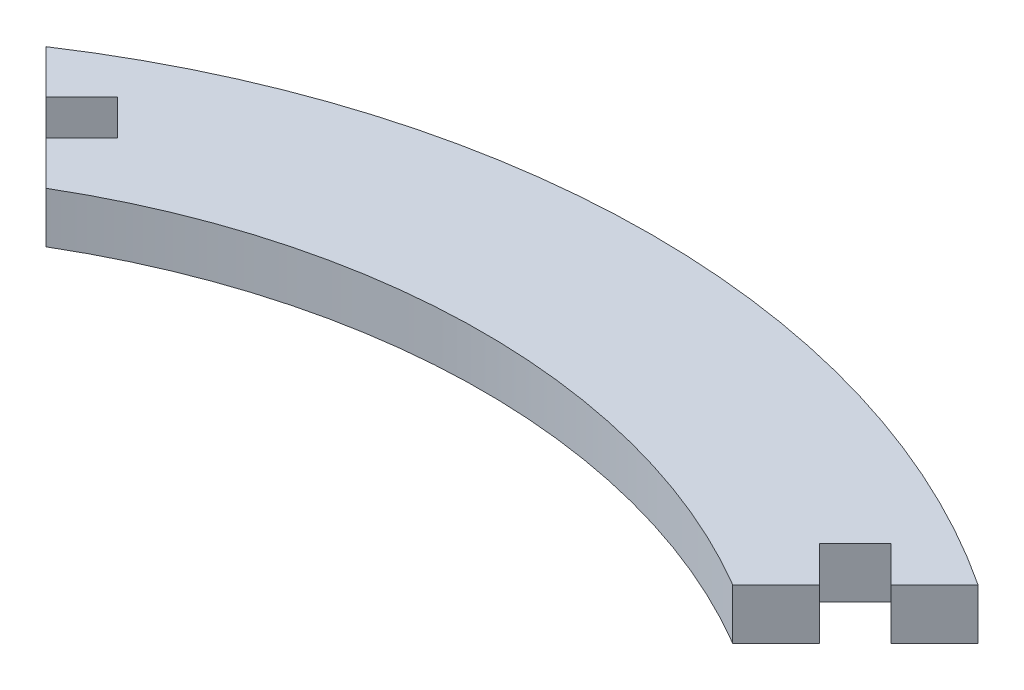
SolidWorks part; units mm, degrees
ref_plane "Alzado" through (0, 0, 0) normal (0, 0, 1) x (1, 0, 0)
ref_plane "Planta" through (0, 0, 0) normal (0, 1, 0) x (1, 0, 0)
ref_plane "Vista lateral" through (0, 0, 0) normal (1, 0, 0) x (0, 0, -1)
sketch "Croquis1" plane through (0, 0, 0) normal (0, 1, 0) x (1, 0, 0)
  line L0 (0, 0) -> (0, 50) construction
  line L1 (-27.5699, 41.7121) -> (-20.3151, 34.4572)
  line L2 (0, 0) -> (-77.3251, 0) construction
  line L4 (0, 0) -> (87.886, 0) construction
  line L5 (27.5699, 41.7121) -> (20.3151, 34.4572)
  arc A0 (20.3151, 34.4572) -> (-20.3151, 34.4572) centre (0, 0) ccw
  arc A1 (27.5699, 41.7121) -> (-27.5699, 41.7121) centre (0, 0) ccw
  circle A3 centre (0, 0) radius 40 construction
  circle A4 centre (0, 0) radius 50 construction
  point P1 (33.4707, 10.233)
  point P6 (23.9076, 7.3093)
  dimension "radio" = 80
  dimension "D2" = 45
  dimension "D1" = 10
  dimension "separacion" = 10
extrude "Saliente-Extruir1" add sketch "Croquis1" along normal blind 3
sketch "Croquis3" plane through (0, 3, 0) normal (0, 1, 0) x (1, 0, 0)
  line L1 (0, 40) -> (0, 50) construction
  line L2 (22.8818, 37.024) -> (20.7605, 39.1453)
  line L3 (25.0032, 39.1453) -> (22.8818, 41.2666)
  line L4 (22.8818, 41.2666) -> (20.7605, 39.1453)
  line L5 (-25.0032, 39.1453) -> (-22.8818, 37.024)
  line L6 (-25.0032, 39.1453) -> (-22.8818, 41.2666)
  line L7 (-22.8818, 41.2666) -> (-20.7605, 39.1453)
  line L8 (25.0032, 39.1453) -> (22.8818, 37.024)
  line L9 (-22.8818, 37.024) -> (-20.7605, 39.1453)
  line L10 (20.3151, 34.4572) -> (27.5699, 41.7121) construction
  arc A2 (20.3151, 34.4572) -> (-20.3151, 34.4572) centre (0, 0) ccw construction
  arc A3 (27.5699, 41.7121) -> (-27.5699, 41.7121) centre (0, 0) ccw construction
  point P19 (23.9425, 38.0846)
  point P20 (23.9425, 38.0846)
  dimension "D2" = 3
  dimension "D3" = 3
  dimension "D7" = 3
extrude "Cortar-Extruir1" cut sketch "Croquis3" against normal blind 3
equation "\"D4@Croquis1\" = \"separacion@Croquis1\""
equation "\"D5@Croquis1\" = \"separacion@Croquis1\""
equation "\"D3@Croquis3\"=\"espesor@Saliente-Extruir1\""
equation "\"D4@Croquis3\" = \"espesor@Saliente-Extruir1\""
equation "\"D7@Croquis3\" = \"D3@Croquis3\""
equation "\"D1@Croquis1\"=10mm"
